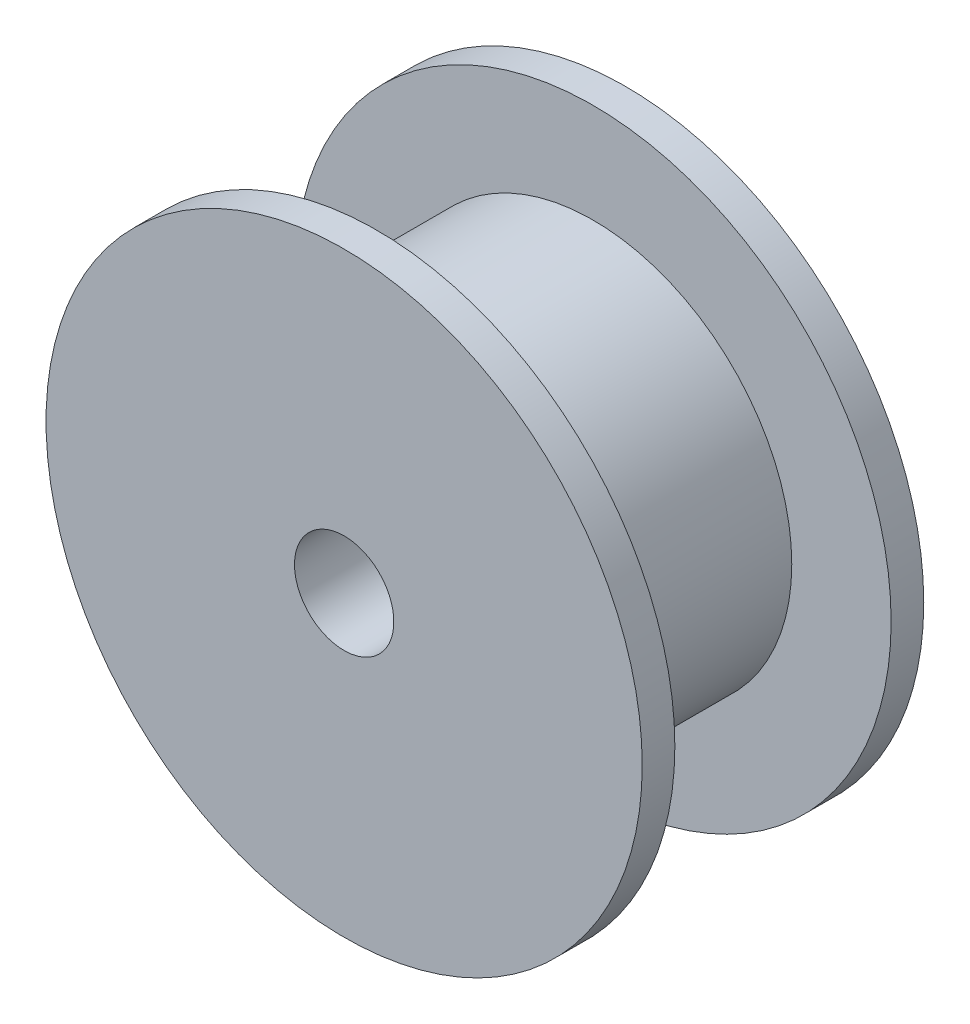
SolidWorks part; units mm, degrees
ref_plane "Спереди" through (0, 0, 0) normal (0, 0, 1) x (1, 0, 0)
ref_plane "Сверху" through (0, 0, 0) normal (0, 1, 0) x (1, 0, 0)
ref_plane "Справа" through (0, 0, 0) normal (1, 0, 0) x (0, 0, -1)
sketch "Эскиз1" plane through (0, 0, 0) normal (0, 1, 0) x (1, 0, 0)
  line L0 (0, 0) -> (0, 11.7713) construction
  line L1 (0, 0) -> (-9, 0)
  line L2 (-9, 0) -> (-9, 0.985)
  line L3 (-9, 0.985) -> (-6, 0.985)
  line L4 (-6, 0.985) -> (-6, 7.515)
  line L5 (-6, 7.515) -> (-9, 7.515)
  line L6 (-9, 7.515) -> (-9, 8.5)
  line L7 (-9, 8.5) -> (0, 8.5)
  line L8 (0, 0) -> (0, 8.5)
  dimension "D1" = 9
  dimension "D2" = 8.5
  dimension "D3" = 6
  dimension "D4" = 6.53
revolve "Повернуть1" add sketch "Эскиз1" angle 360 about L0
sketch "Эскиз2" plane through (0, 0, -8.5) normal (0, 0, -1) x (-1, 0, 0)
  circle A0 centre (0, 0) radius 1.5
  dimension "D1" = 3
extrude "Вырез-Вытянуть1" cut sketch "Эскиз2" against normal blind 29
